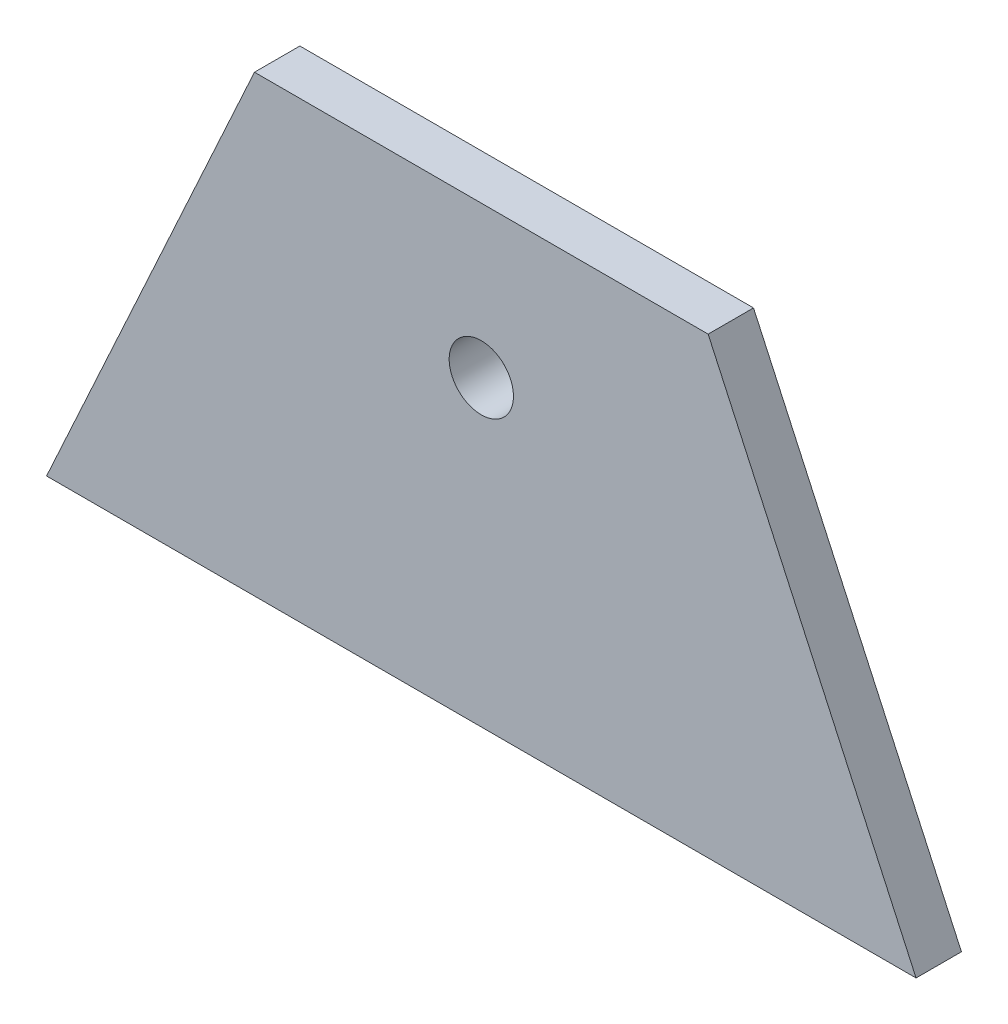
SolidWorks part; units mm, degrees
ref_plane "Face" through (0, 0, 0) normal (0, 0, 1) x (1, 0, 0)
ref_plane "Dessus" through (0, 0, 0) normal (0, 1, 0) x (1, 0, 0)
ref_plane "Droite" through (0, 0, 0) normal (1, 0, 0) x (0, 0, -1)
sketch "Esquisse1" plane through (0, 0, 0) normal (0, 0, 1) x (1, 0, 0)
  line L0 (0, 0) -> (230, 0)
  line L1 (230, 0) -> (175, 120)
  line L2 (175, 120) -> (55, 120)
  line L3 (55, 120) -> (0, 0)
  circle A0 centre (115, 80) radius 8.5
  dimension "D6" = 17
  dimension "D1" = 230
  dimension "D2" = 120
  dimension "D3" = 120
  dimension "D4" = 55
  dimension "D5" = 115
  dimension "D7" = 80
extrude "Base-Extrusion" add sketch "Esquisse1" along normal blind 12
equation "\"D4@Esquisse1\" = (\"D1@Esquisse1\"-\"D3@Esquisse1\")/2"
